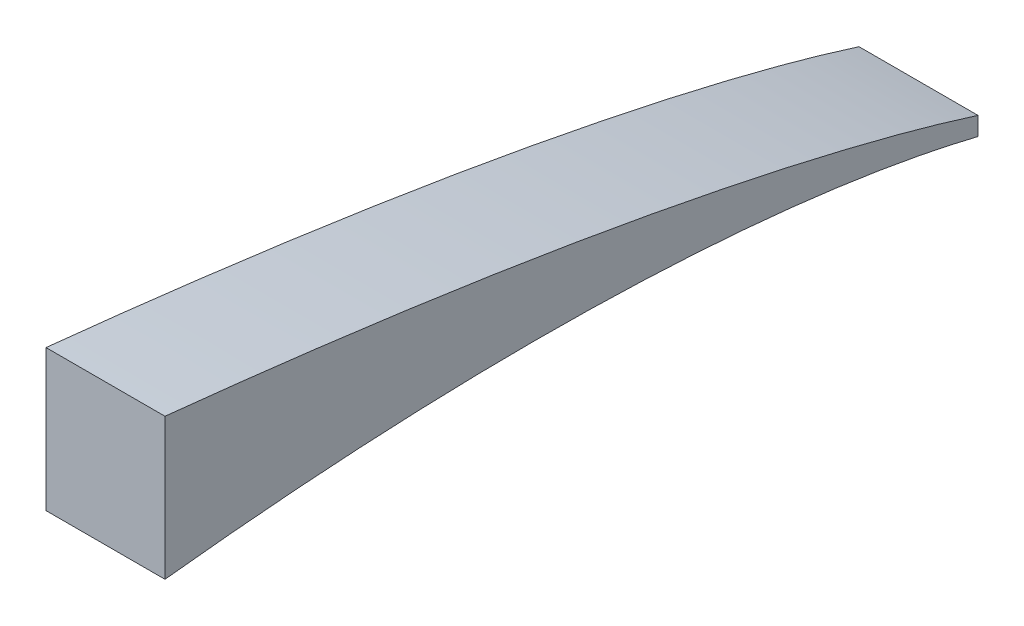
SolidWorks part; units mm, degrees
ref_plane "Front Plane" through (0, 0, 0) normal (0, 0, 1) x (1, 0, 0)
ref_plane "Top Plane" through (0, 0, 0) normal (0, 1, 0) x (1, 0, 0)
ref_plane "Right Plane" through (0, 0, 0) normal (1, 0, 0) x (0, 0, -1)
curve "Curve1"
sketch "Sketch1" plane through (0, 0, 0) normal (1, 0, 0) x (0, 0, -1)
  line L1 (0, 0) -> (0, 95.7684) construction
  line L2 (68.2625, 18.3471) -> (68.2625, 7.0409)
  line L3 (133.35, 6.6637) -> (133.35, 5.1955)
  spline S0 degree 3 poles (68.2625, 7.0409) (69.782, 7.2104) (73.625, 7.6114) (79.8029, 8.1339) (86.7744, 8.5503) (93.6864, 8.7782) (100.4641, 8.8049) (107.0318, 8.6286) (113.3143, 8.2533) (119.236, 7.6839) (124.7265, 6.9422) (129.3863, 6.1083) (132.1999, 5.4788) (133.35, 5.1955) knots 0.741103 0.741103 0.741103 0.741103 0.756094 0.778989 0.80189 0.824567 0.846792 0.868338 0.888978 0.908492 0.926659 0.943286 0.954903 0.954903 0.954903 0.954903
  spline S2 degree 3 poles (133.35, 6.6637) (133.0284, 6.7668) (131.6243, 7.2091) (129.0223, 7.9736) (125.4363, 8.9375) (121.5437, 9.8985) (117.367, 10.8497) (112.9309, 11.7852) (108.2627, 12.7002) (103.3896, 13.5833) (98.3422, 14.4334) (93.1497, 15.2395) (87.8456, 16.0032) (82.4639, 16.7184) (77.0437, 17.3828) (72.3057, 17.9237) (69.3783, 18.2332) (68.2625, 18.3471) knots 1.047399 1.047399 1.047399 1.047399 1.05071 1.061833 1.073989 1.087118 1.101145 1.115991 1.13157 1.147788 1.164551 1.181758 1.199312 1.217095 1.23499 1.252857 1.263854 1.263854 1.263854 1.263854
  dimension "D2" = 68.2625
  dimension "D3" = 133.35
extrude "Boss-Extrude1" add sketch "Sketch1" along normal blind 9.525
